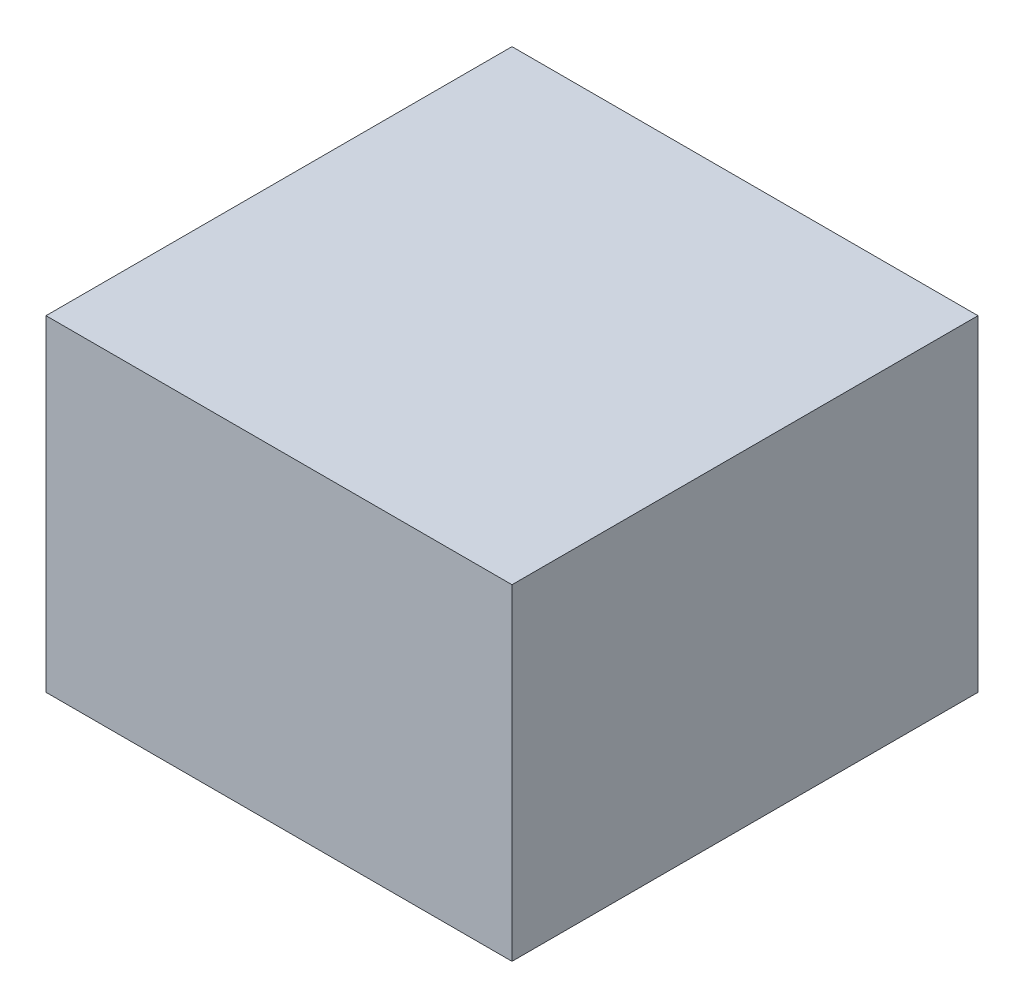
SolidWorks part; units mm, degrees
ref_plane "Front Plane" through (0, 0, 0) normal (0, 0, 1) x (1, 0, 0)
ref_plane "Top Plane" through (0, 0, 0) normal (0, 1, 0) x (1, 0, 0)
ref_plane "Right Plane" through (0, 0, 0) normal (1, 0, 0) x (0, 0, -1)
sketch "Sketch1" plane through (0, 0, 0) normal (0, 1, 0) x (1, 0, 0)
  line L1 (-22.5, -22.5) -> (22.5, -22.5)
  line L2 (-22.5, -22.5) -> (-22.5, 22.5)
  line L3 (-22.5, 22.5) -> (22.5, 22.5)
  line L4 (22.5, -22.5) -> (22.5, 22.5)
  line L5 (-22.5, -22.5) -> (22.5, 22.5) construction
  line L6 (-22.5, 22.5) -> (22.5, -22.5) construction
  point P0 (0, 0)
  dimension "D1" = 45
  dimension "D2" = 45
extrude "Boss-Extrude1" add sketch "Sketch1" along normal blind 31.5
